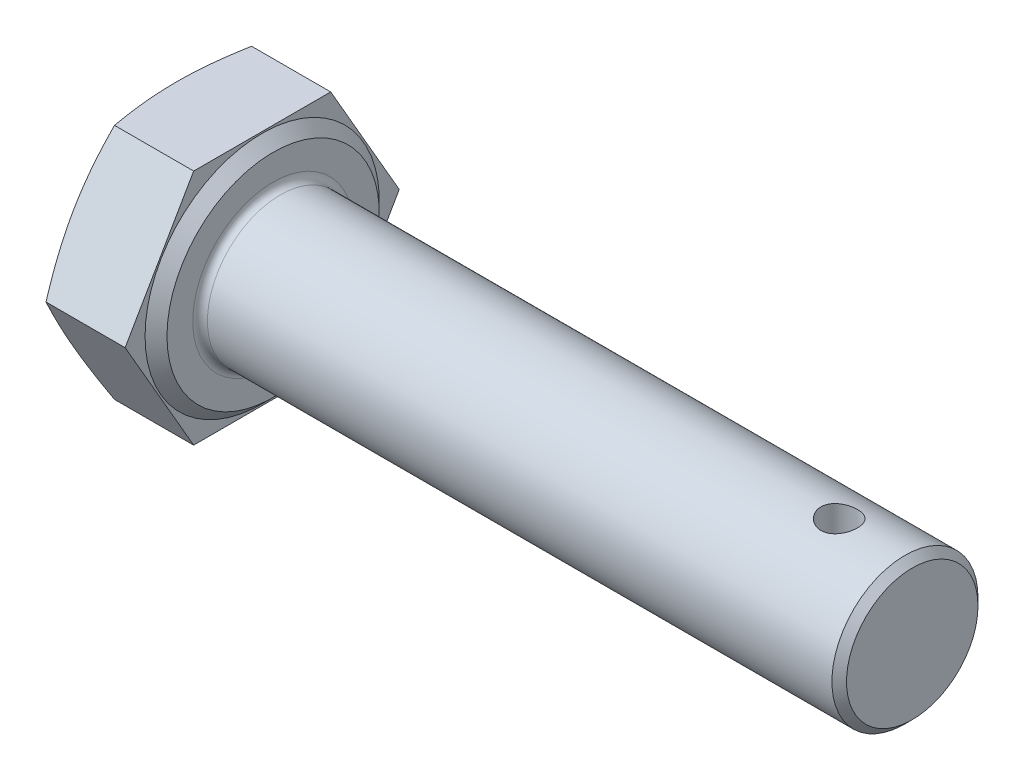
SolidWorks part; units mm, degrees
ref_plane "Front" through (0, 0, 0) normal (0, 0, 1) x (1, 0, 0)
ref_plane "Top" through (0, 0, 0) normal (0, 1, 0) x (1, 0, 0)
ref_plane "Right" through (0, 0, 0) normal (1, 0, 0) x (0, 0, -1)
other "Configuration Table"
sketch "Sketch2" plane through (0, 0, 0) normal (1, 0, 0) x (0, 0, -1)
  line L1 (7.5056, 0) -> (3.7528, 6.5)
  line L2 (3.7528, 6.5) -> (-3.7528, 6.5)
  line L3 (-3.7528, 6.5) -> (-7.5056, 0)
  line L4 (-7.5056, 0) -> (-3.7528, -6.5)
  line L5 (-3.7528, -6.5) -> (3.7528, -6.5)
  line L6 (3.7528, -6.5) -> (7.5056, 0)
  circle A0 centre (0, 0) radius 6.5 construction
extrude "BaseHead" add sketch "Sketch2" along normal blind 5.3
sketch "Sketch3" plane through (0, 0, 0) normal (0, 1, 0) x (1, 0, 0)
  line L0 (5.3, 7.5056) -> (5.3, 5.815)
  line L2 (5.3, 5.815) -> (4.7, 6.415)
  line L3 (4.7, 6.415) -> (4.7, 7.5056)
  line L5 (4.7, 7.5056) -> (5.3, 7.5056)
  line L6 (-0.9571, 0) -> (7.6478, 0) construction
  line L9 (5.3, 7.5056) -> (0, 7.5056) construction
  dimension "D1" = 45
  dimension "c" = 0.6
  dimension "dw" = 11.63
revolve "BearingFace" cut sketch "Sketch3" angle 360 about L6
sketch "Sketch4" plane through (0, 0, 0) normal (0, 1, 0) x (1, 0, 0)
  line L0 (-0.4935, 0) -> (3.5626, 0) construction
  line L2 (0, 7.5056) -> (0.366, 7.5056)
  line L4 (0.366, 7.5056) -> (0, 6.5)
  line L6 (0, 6.5) -> (0, 7.5056)
  line L7 (4.7, 7.5056) -> (0, 7.5056) construction
revolve "HeadChamfer" cut sketch "Sketch4" angle 360 about L0
sketch "Sketch5" plane through (5.3, 0, 0) normal (1, 0, 0) x (0, 0, -1)
  circle A0 centre (0, 0) radius 4
extrude "BaseBody" add sketch "Sketch5" along normal blind 35
chamfer "Chamfer1" distance 0.4 angle 45 1 edges at (40.3, 0, -4)
ref_plane "Plane1" through (23.3, 0, 0) normal (1, 0, 0) x (0, 0, -1)
sketch "Sketch6" plane through (0, 0, 0) normal (0, 1, 0) x (1, 0, 0)
  line L3 (5.3, -5.815) -> (5.3, 5.815) construction
  line L4 (39.9, 0) -> (5.3, 0) construction
  circle A0 centre (36.3, 0) radius 1
  dimension "d1" = 2
  dimension "lh" = 31
extrude "Hole" cut sketch "Sketch6" against normal through all and the other way through all
fillet "HeadFillet" radius 0.4 1 edges at (5.3, 0, -4)
sketch "Sketch7" plane through (0, 0, 0) normal (0, 0, 1) x (1, 0, 0)
  line L0 (39.4, 4.2) -> (39.9, 4.2)
  line L1 (39.9, 4.2) -> (39.9, 4)
  line L2 (39.9, 4) -> (39.65, 3.567)
  line L3 (39.4, 4) -> (39.65, 3.567)
  line L4 (39.4, 4.2) -> (39.4, 4)
  line L5 (6.5265, 0) -> (0, 0) construction
  line L6 (39.4, 4) -> (39.9, 4) construction
  line L7 (39.65, 4) -> (39.65, 3.567) construction
  point P5 (39.65, 4.2)
revolve "Cut-Revolve10" [suppressed] cut sketch "Sketch7" angle 360 about L5
pattern_linear "LPattern10" [suppressed] count 28 spacing 0.6
equation "\"D2@Sketch4\" = \"s@Sketch2\""
equation "\"b@ThreadCosmetic1\" = \"l@BaseBody\" - \"lg@Plane1\""
equation "\"D1@Chamfer1\" = 0.05 * \"d@Sketch5\""
equation "\"D2@Sketch7\" = (  \"d@Sketch5\" -\"D2@ThreadCosmetic1\" )  / 2"
equation "\"D3@LPattern10\" = \"D2@Sketch7\" * 1.2"
equation "\"D1@LPattern10\" = \"b@ThreadCosmetic1\" / \"D3@LPattern10\""
